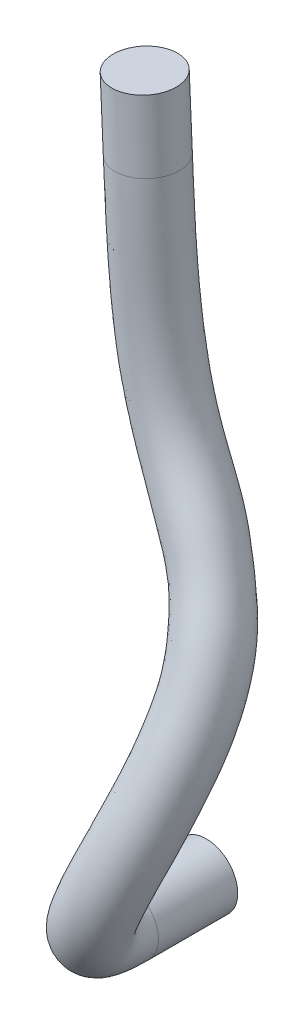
SolidWorks part; units mm, degrees
ref_plane "Front Plane" through (0, 0, 0) normal (0, 0, 1) x (1, 0, 0)
ref_plane "Top Plane" through (0, 0, 0) normal (0, 1, 0) x (1, 0, 0)
ref_plane "Right Plane" through (0, 0, 0) normal (1, 0, 0) x (0, 0, -1)
sketch3d "3DSketch1"
  line L0 (0, 0, 0) -> (0, 0, 15.968)
  line L1 (-6.254, 140.2438, 6.1294) -> (-5.6189, 126.001, 6.1294)
  spline S0 degree 3 poles (-5.6189, 126.001, 6.1294) (-4.8177, 108.0342, 6.1294) (-5.8135, 80.907, 3.9433) (26.3719, 49.7582, 12.9913) (0, 0, 36.4215) (0, 0, 15.968) knots 0 0 0 0 0.348572 0.625477 1 1 1 1
ref_plane "Plane1" through (-6.254, 140.2438, 6.1294) normal (0.0445, -0.999, 0) x (0.999, 0.0445, 0)
sketch "Sketch2" plane through (-6.254, 140.2438, 6.1294) normal (0.0445, -0.999, 0) x (0.999, 0.0445, 0)
  circle A0 centre (0, 0) radius 6.35
  dimension "D1" = 12.7
sweep "Sweep1" add profiles "Sketch2" path "3DSketch1"
